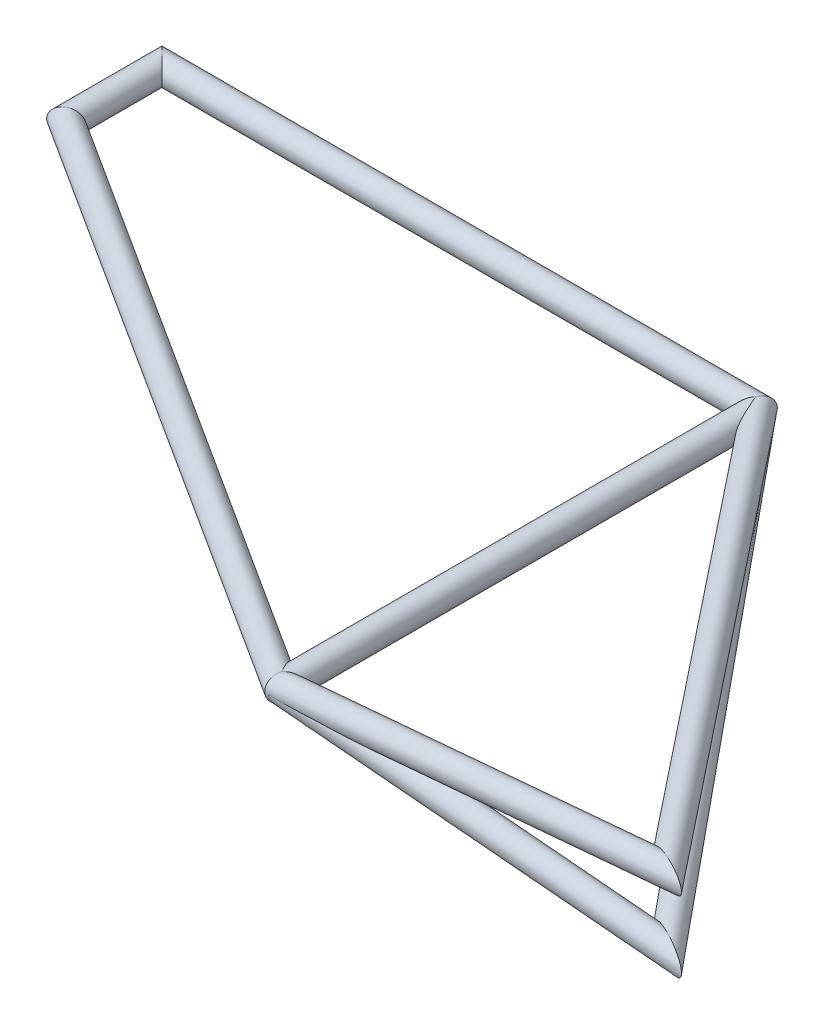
SolidWorks part; units mm, degrees
ref_plane "Front Plane" through (0, 0, 0) normal (0, 0, 1) x (1, 0, 0)
ref_plane "Top Plane" through (0, 0, 0) normal (0, 1, 0) x (1, 0, 0)
ref_plane "Right Plane" through (0, 0, 0) normal (1, 0, 0) x (0, 0, -1)
sketch3d "3DSketch2"
  line L1 (0, 0, 0) -> (99.819, 0, 0) construction
  line L2 (0, 0, 0) -> (323.7633, 28.3256, 0)
  line L3 (0, 0, 0) -> (0, 0, -400)
  line L4 (0, 0, -400) -> (-500, 0, -400)
  line L5 (-500, 0, -400) -> (-500, 0, -320)
  line L6 (-500, 0, -320) -> (0, 0, 0)
  line L7 (0, 0, -400) -> (323.7633, 28.3256, 0)
  line L9 (0, 0, 0) -> (323.7633, -28.3256, 0)
  line L10 (0, 0, -400) -> (323.7633, -28.3256, 0)
  dimension "D1" = 5
  dimension "D2" = 5
  dimension "D3" = 400
  dimension "D4" = 80
  dimension "D5" = 500
  dimension "D6" = 325
  dimension "D7" = 325
other "Pipe 0.5 SCH 40(6)"
ref_plane "Plane4" through (-500, 0, -400) normal (0, 0, 1) x (1, 0, 0)
sketch "Sketch1" plane through (-500, 0, -400) normal (0, 0, 1) x (1, 0, 0)
  circle A0 centre (0, 0) radius 7.8994
  circle A1 centre (0, 0) radius 10.668
  circle A2 centre (0, 0) radius 6.35 construction
  point P5 (0, 0)
  dimension "In_dia" = 15.7988
  dimension "Out_dia" = 21.336
  dimension "D1" = 12.7
